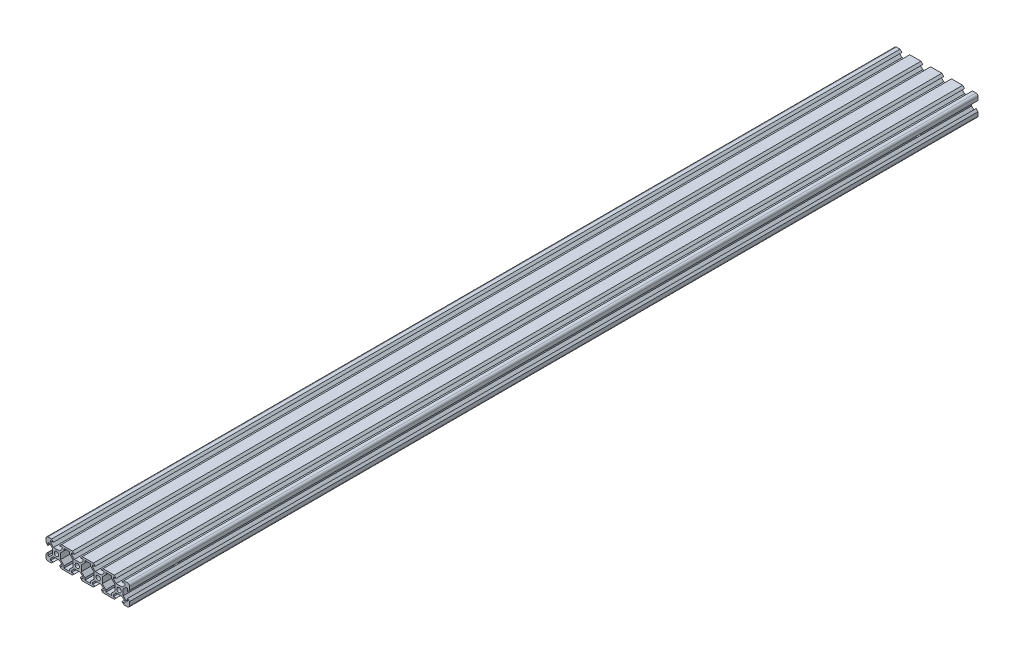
SolidWorks part; units mm, degrees
ref_plane "Front Plane" through (0, 0, 0) normal (0, 0, 1) x (1, 0, 0)
ref_plane "Top Plane" through (0, 0, 0) normal (0, 1, 0) x (1, 0, 0)
ref_plane "Right Plane" through (0, 0, 0) normal (1, 0, 0) x (0, 0, -1)
imported_body "Imported1"
sketch "Sketch1" plane through (0, 0, 25.4) normal (0, 0, 1) x (1, 0, 0)
  line L12 (-17.3007, -8.2) -> (-17.3007, -6.24)
  line L13 (-22.6993, -8.2) -> (-17.3007, -8.2)
  line L14 (-22.6993, -6.24) -> (-22.6993, -8.2)
  line L15 (-26.0993, -2.84) -> (-22.6993, -6.24)
  line L16 (-26.0993, 2.84) -> (-26.0993, -2.84)
  line L17 (-22.6993, 6.24) -> (-26.0993, 2.84)
  line L18 (-22.6993, 8.2) -> (-22.6993, 6.24)
  line L19 (-17.3007, 8.2) -> (-22.6993, 8.2)
  line L20 (-17.3007, 6.24) -> (-17.3007, 8.2)
  line L21 (-13.9007, 2.84) -> (-17.3007, 6.24)
  line L22 (-13.9007, -2.84) -> (-13.9007, 2.84)
  line L23 (-17.3007, -6.24) -> (-13.9007, -2.84)
  line L24 (-17.3007, -8.2) -> (-17.3007, -6.24)
  line L25 (-22.6993, -8.2) -> (-17.3007, -8.2)
  line L26 (-22.6993, -6.24) -> (-22.6993, -8.2)
  line L27 (-26.0993, -2.84) -> (-22.6993, -6.24)
  line L28 (-26.0993, 2.84) -> (-26.0993, -2.84)
  line L29 (-22.6993, 6.24) -> (-26.0993, 2.84)
  line L30 (-22.6993, 8.2) -> (-22.6993, 6.24)
  line L31 (-17.3007, 8.2) -> (-22.6993, 8.2)
  line L32 (-17.3007, 6.24) -> (-17.3007, 8.2)
  line L33 (-13.9007, 2.84) -> (-17.3007, 6.24)
  line L34 (-13.9007, -2.84) -> (-13.9007, 2.84)
  line L35 (-17.3007, -6.24) -> (-13.9007, -2.84)
  line L36 (-2.6993, 8.2) -> (-2.6993, 6.24)
  line L37 (2.6993, 8.2) -> (-2.6993, 8.2)
  line L38 (2.6993, 6.24) -> (2.6993, 8.2)
  line L39 (6.0993, 2.84) -> (2.6993, 6.24)
  line L40 (6.0993, -2.84) -> (6.0993, 2.84)
  line L41 (2.6993, -6.24) -> (6.0993, -2.84)
  line L42 (2.6993, -8.2) -> (2.6993, -6.24)
  line L43 (-2.6993, -8.2) -> (2.6993, -8.2)
  line L44 (-2.6993, -6.24) -> (-2.6993, -8.2)
  line L45 (-6.0993, -2.84) -> (-2.6993, -6.24)
  line L46 (-6.0993, 2.84) -> (-6.0993, -2.84)
  line L47 (-2.6993, 6.24) -> (-6.0993, 2.84)
  line L48 (-2.6993, 8.2) -> (-2.6993, 6.24)
  line L49 (2.6993, 8.2) -> (-2.6993, 8.2)
  line L50 (2.6993, 6.24) -> (2.6993, 8.2)
  line L51 (6.0993, 2.84) -> (2.6993, 6.24)
  line L52 (6.0993, -2.84) -> (6.0993, 2.84)
  line L53 (2.6993, -6.24) -> (6.0993, -2.84)
  line L54 (2.6993, -8.2) -> (2.6993, -6.24)
  line L55 (-2.6993, -8.2) -> (2.6993, -8.2)
  line L56 (-2.6993, -6.24) -> (-2.6993, -8.2)
  line L57 (-6.0993, -2.84) -> (-2.6993, -6.24)
  line L58 (-6.0993, 2.84) -> (-6.0993, -2.84)
  line L59 (-2.6993, 6.24) -> (-6.0993, 2.84)
  line L60 (13.9007, 2.84) -> (13.9007, -2.84)
  line L61 (17.3007, 6.24) -> (13.9007, 2.84)
  line L62 (17.3007, 8.2) -> (17.3007, 6.24)
  line L63 (22.6993, 8.2) -> (17.3007, 8.2)
  line L64 (22.6993, 6.24) -> (22.6993, 8.2)
  line L65 (26.0993, 2.84) -> (22.6993, 6.24)
  line L66 (26.0993, -2.84) -> (26.0993, 2.84)
  line L67 (22.6993, -6.24) -> (26.0993, -2.84)
  line L68 (22.6993, -8.2) -> (22.6993, -6.24)
  line L69 (17.3007, -8.2) -> (22.6993, -8.2)
  line L70 (17.3007, -6.24) -> (17.3007, -8.2)
  line L71 (13.9007, -2.84) -> (17.3007, -6.24)
  line L72 (13.9007, 2.84) -> (13.9007, -2.84)
  line L73 (17.3007, 6.24) -> (13.9007, 2.84)
  line L74 (17.3007, 8.2) -> (17.3007, 6.24)
  line L75 (22.6993, 8.2) -> (17.3007, 8.2)
  line L76 (22.6993, 6.24) -> (22.6993, 8.2)
  line L77 (26.0993, 2.84) -> (22.6993, 6.24)
  line L78 (26.0993, -2.84) -> (26.0993, 2.84)
  line L79 (22.6993, -6.24) -> (26.0993, -2.84)
  line L80 (22.6993, -8.2) -> (22.6993, -6.24)
  line L81 (17.3007, -8.2) -> (22.6993, -8.2)
  line L82 (17.3007, -6.24) -> (17.3007, -8.2)
  line L83 (13.9007, -2.84) -> (17.3007, -6.24)
  line L104 (-15.4993, -8.2) -> (-15.4993, -6.56)
  line L105 (-15.4993, -6.56) -> (-12.84, -3.9007)
  line L106 (-12.84, -3.9007) -> (-7.16, -3.9007)
  line L107 (-7.16, -3.9007) -> (-4.5007, -6.56)
  line L108 (-4.5007, -6.56) -> (-4.5007, -8.2)
  line L109 (-4.5007, -8.2) -> (-7.16, -8.2)
  line L110 (-7.16, -8.2) -> (-5.36, -10)
  line L111 (-5.36, -10) -> (5.36, -10)
  line L112 (5.36, -10) -> (7.16, -8.2)
  line L113 (7.16, -8.2) -> (4.5007, -8.2)
  line L114 (4.5007, -8.2) -> (4.5007, -6.56)
  line L115 (4.5007, -6.56) -> (7.16, -3.9007)
  line L116 (7.16, -3.9007) -> (12.84, -3.9007)
  line L117 (12.84, -3.9007) -> (15.4993, -6.56)
  line L118 (15.4993, -6.56) -> (15.4993, -8.2)
  line L119 (15.4993, -8.2) -> (12.84, -8.2)
  line L120 (12.84, -8.2) -> (14.64, -10)
  line L121 (14.64, -10) -> (25.36, -10)
  line L122 (25.36, -10) -> (27.16, -8.2)
  line L123 (27.16, -8.2) -> (24.5007, -8.2)
  line L124 (24.5007, -8.2) -> (24.5007, -6.56)
  line L125 (24.5007, -6.56) -> (27.16, -3.9007)
  line L126 (27.16, -3.9007) -> (32.84, -3.9007)
  line L127 (32.84, -3.9007) -> (35.4993, -6.56)
  line L128 (35.4993, -6.56) -> (35.4993, -8.2)
  line L129 (35.4993, -8.2) -> (32.84, -8.2)
  line L130 (32.84, -8.2) -> (34.64, -10)
  line L131 (34.64, -10) -> (38, -10)
  line L132 (40, -8) -> (40, -4.64)
  line L133 (40, -4.64) -> (38.2, -2.84)
  line L134 (38.2, -2.84) -> (38.2, -5.4993)
  line L135 (38.2, -5.4993) -> (36.56, -5.4993)
  line L136 (36.56, -5.4993) -> (33.9007, -2.84)
  line L137 (33.9007, -2.84) -> (33.9007, 2.84)
  line L138 (33.9007, 2.84) -> (36.56, 5.4993)
  line L139 (36.56, 5.4993) -> (38.2, 5.4993)
  line L140 (38.2, 5.4993) -> (38.2, 2.84)
  line L141 (38.2, 2.84) -> (40, 4.64)
  line L142 (40, 4.64) -> (40, 8)
  line L143 (38, 10) -> (34.64, 10)
  line L144 (34.64, 10) -> (32.84, 8.2)
  line L145 (32.84, 8.2) -> (35.4993, 8.2)
  line L146 (35.4993, 8.2) -> (35.4993, 6.56)
  line L147 (35.4993, 6.56) -> (32.84, 3.9007)
  line L148 (32.84, 3.9007) -> (27.16, 3.9007)
  line L149 (27.16, 3.9007) -> (24.5007, 6.56)
  line L150 (24.5007, 6.56) -> (24.5007, 8.2)
  line L151 (24.5007, 8.2) -> (27.16, 8.2)
  line L152 (27.16, 8.2) -> (25.36, 10)
  line L153 (25.36, 10) -> (14.64, 10)
  line L154 (14.64, 10) -> (12.84, 8.2)
  line L155 (12.84, 8.2) -> (15.4993, 8.2)
  line L156 (15.4993, 8.2) -> (15.4993, 6.56)
  line L157 (15.4993, 6.56) -> (12.84, 3.9007)
  line L158 (12.84, 3.9007) -> (7.16, 3.9007)
  line L159 (7.16, 3.9007) -> (4.5007, 6.56)
  line L160 (4.5007, 6.56) -> (4.5007, 8.2)
  line L161 (4.5007, 8.2) -> (7.16, 8.2)
  line L162 (7.16, 8.2) -> (5.36, 10)
  line L163 (5.36, 10) -> (-5.36, 10)
  line L164 (-5.36, 10) -> (-7.16, 8.2)
  line L165 (-7.16, 8.2) -> (-4.5007, 8.2)
  line L166 (-4.5007, 8.2) -> (-4.5007, 6.56)
  line L167 (-4.5007, 6.56) -> (-7.16, 3.9007)
  line L168 (-7.16, 3.9007) -> (-12.84, 3.9007)
  line L169 (-12.84, 3.9007) -> (-15.4993, 6.56)
  line L170 (-15.4993, 6.56) -> (-15.4993, 8.2)
  line L171 (-15.4993, 8.2) -> (-12.84, 8.2)
  line L172 (-12.84, 8.2) -> (-14.64, 10)
  line L173 (-14.64, 10) -> (-25.36, 10)
  line L174 (-25.36, 10) -> (-27.16, 8.2)
  line L175 (-27.16, 8.2) -> (-24.5007, 8.2)
  line L176 (-24.5007, 8.2) -> (-24.5007, 6.56)
  line L177 (-24.5007, 6.56) -> (-27.16, 3.9007)
  line L178 (-27.16, 3.9007) -> (-32.84, 3.9007)
  line L179 (-32.84, 3.9007) -> (-35.4993, 6.56)
  line L180 (-35.4993, 6.56) -> (-35.4993, 8.2)
  line L181 (-35.4993, 8.2) -> (-32.84, 8.2)
  line L182 (-32.84, 8.2) -> (-34.64, 10)
  line L183 (-34.64, 10) -> (-38, 10)
  line L184 (-40, 8) -> (-40, 4.64)
  line L185 (-40, 4.64) -> (-38.2, 2.84)
  line L186 (-38.2, 2.84) -> (-38.2, 5.4993)
  line L187 (-38.2, 5.4993) -> (-36.56, 5.4993)
  line L188 (-36.56, 5.4993) -> (-33.9007, 2.84)
  line L189 (-33.9007, 2.84) -> (-33.9007, -2.84)
  line L190 (-33.9007, -2.84) -> (-36.56, -5.4993)
  line L191 (-36.56, -5.4993) -> (-38.2, -5.4993)
  line L192 (-38.2, -5.4993) -> (-38.2, -2.84)
  line L193 (-38.2, -2.84) -> (-40, -4.64)
  line L194 (-40, -4.64) -> (-40, -8)
  line L195 (-38, -10) -> (-34.64, -10)
  line L196 (-34.64, -10) -> (-32.84, -8.2)
  line L197 (-32.84, -8.2) -> (-35.4993, -8.2)
  line L198 (-35.4993, -8.2) -> (-35.4993, -6.56)
  line L199 (-35.4993, -6.56) -> (-32.84, -3.9007)
  line L200 (-32.84, -3.9007) -> (-27.16, -3.9007)
  line L201 (-27.16, -3.9007) -> (-24.5007, -6.56)
  line L202 (-24.5007, -6.56) -> (-24.5007, -8.2)
  line L203 (-24.5007, -8.2) -> (-27.16, -8.2)
  line L204 (-27.16, -8.2) -> (-25.36, -10)
  line L205 (-25.36, -10) -> (-14.64, -10)
  line L206 (-14.64, -10) -> (-12.84, -8.2)
  line L207 (-12.84, -8.2) -> (-15.4993, -8.2)
  line L208 (-15.4993, -8.2) -> (-15.4993, -6.56)
  line L209 (-15.4993, -6.56) -> (-12.84, -3.9007)
  line L210 (-12.84, -3.9007) -> (-7.16, -3.9007)
  line L211 (-7.16, -3.9007) -> (-4.5007, -6.56)
  line L212 (-4.5007, -6.56) -> (-4.5007, -8.2)
  line L213 (-4.5007, -8.2) -> (-7.16, -8.2)
  line L214 (-7.16, -8.2) -> (-5.36, -10)
  line L215 (-5.36, -10) -> (5.36, -10)
  line L216 (5.36, -10) -> (7.16, -8.2)
  line L217 (7.16, -8.2) -> (4.5007, -8.2)
  line L218 (4.5007, -8.2) -> (4.5007, -6.56)
  line L219 (4.5007, -6.56) -> (7.16, -3.9007)
  line L220 (7.16, -3.9007) -> (12.84, -3.9007)
  line L221 (12.84, -3.9007) -> (15.4993, -6.56)
  line L222 (15.4993, -6.56) -> (15.4993, -8.2)
  line L223 (15.4993, -8.2) -> (12.84, -8.2)
  line L224 (12.84, -8.2) -> (14.64, -10)
  line L225 (14.64, -10) -> (25.36, -10)
  line L226 (25.36, -10) -> (27.16, -8.2)
  line L227 (27.16, -8.2) -> (24.5007, -8.2)
  line L228 (24.5007, -8.2) -> (24.5007, -6.56)
  line L229 (24.5007, -6.56) -> (27.16, -3.9007)
  line L230 (27.16, -3.9007) -> (32.84, -3.9007)
  line L231 (32.84, -3.9007) -> (35.4993, -6.56)
  line L232 (35.4993, -6.56) -> (35.4993, -8.2)
  line L233 (35.4993, -8.2) -> (32.84, -8.2)
  line L234 (32.84, -8.2) -> (34.64, -10)
  line L235 (34.64, -10) -> (38, -10)
  line L236 (40, -8) -> (40, -4.64)
  line L237 (40, -4.64) -> (38.2, -2.84)
  line L238 (38.2, -2.84) -> (38.2, -5.4993)
  line L239 (38.2, -5.4993) -> (36.56, -5.4993)
  line L240 (36.56, -5.4993) -> (33.9007, -2.84)
  line L241 (33.9007, -2.84) -> (33.9007, 2.84)
  line L242 (33.9007, 2.84) -> (36.56, 5.4993)
  line L243 (36.56, 5.4993) -> (38.2, 5.4993)
  line L244 (38.2, 5.4993) -> (38.2, 2.84)
  line L245 (38.2, 2.84) -> (40, 4.64)
  line L246 (40, 4.64) -> (40, 8)
  line L247 (38, 10) -> (34.64, 10)
  line L248 (34.64, 10) -> (32.84, 8.2)
  line L249 (32.84, 8.2) -> (35.4993, 8.2)
  line L250 (35.4993, 8.2) -> (35.4993, 6.56)
  line L251 (35.4993, 6.56) -> (32.84, 3.9007)
  line L252 (32.84, 3.9007) -> (27.16, 3.9007)
  line L253 (27.16, 3.9007) -> (24.5007, 6.56)
  line L254 (24.5007, 6.56) -> (24.5007, 8.2)
  line L255 (24.5007, 8.2) -> (27.16, 8.2)
  line L256 (27.16, 8.2) -> (25.36, 10)
  line L257 (25.36, 10) -> (14.64, 10)
  line L258 (14.64, 10) -> (12.84, 8.2)
  line L259 (12.84, 8.2) -> (15.4993, 8.2)
  line L260 (15.4993, 8.2) -> (15.4993, 6.56)
  line L261 (15.4993, 6.56) -> (12.84, 3.9007)
  line L262 (12.84, 3.9007) -> (7.16, 3.9007)
  line L263 (7.16, 3.9007) -> (4.5007, 6.56)
  line L264 (4.5007, 6.56) -> (4.5007, 8.2)
  line L265 (4.5007, 8.2) -> (7.16, 8.2)
  line L266 (7.16, 8.2) -> (5.36, 10)
  line L267 (5.36, 10) -> (-5.36, 10)
  line L268 (-5.36, 10) -> (-7.16, 8.2)
  line L269 (-7.16, 8.2) -> (-4.5007, 8.2)
  line L270 (-4.5007, 8.2) -> (-4.5007, 6.56)
  line L271 (-4.5007, 6.56) -> (-7.16, 3.9007)
  line L272 (-7.16, 3.9007) -> (-12.84, 3.9007)
  line L273 (-12.84, 3.9007) -> (-15.4993, 6.56)
  line L274 (-15.4993, 6.56) -> (-15.4993, 8.2)
  line L275 (-15.4993, 8.2) -> (-12.84, 8.2)
  line L276 (-12.84, 8.2) -> (-14.64, 10)
  line L277 (-14.64, 10) -> (-25.36, 10)
  line L278 (-25.36, 10) -> (-27.16, 8.2)
  line L279 (-27.16, 8.2) -> (-24.5007, 8.2)
  line L280 (-24.5007, 8.2) -> (-24.5007, 6.56)
  line L281 (-24.5007, 6.56) -> (-27.16, 3.9007)
  line L282 (-27.16, 3.9007) -> (-32.84, 3.9007)
  line L283 (-32.84, 3.9007) -> (-35.4993, 6.56)
  line L284 (-35.4993, 6.56) -> (-35.4993, 8.2)
  line L285 (-35.4993, 8.2) -> (-32.84, 8.2)
  line L286 (-32.84, 8.2) -> (-34.64, 10)
  line L287 (-34.64, 10) -> (-38, 10)
  line L288 (-40, 8) -> (-40, 4.64)
  line L289 (-40, 4.64) -> (-38.2, 2.84)
  line L290 (-38.2, 2.84) -> (-38.2, 5.4993)
  line L291 (-38.2, 5.4993) -> (-36.56, 5.4993)
  line L292 (-36.56, 5.4993) -> (-33.9007, 2.84)
  line L293 (-33.9007, 2.84) -> (-33.9007, -2.84)
  line L294 (-33.9007, -2.84) -> (-36.56, -5.4993)
  line L295 (-36.56, -5.4993) -> (-38.2, -5.4993)
  line L296 (-38.2, -5.4993) -> (-38.2, -2.84)
  line L297 (-38.2, -2.84) -> (-40, -4.64)
  line L298 (-40, -4.64) -> (-40, -8)
  line L299 (-38, -10) -> (-34.64, -10)
  line L300 (-34.64, -10) -> (-32.84, -8.2)
  line L301 (-32.84, -8.2) -> (-35.4993, -8.2)
  line L302 (-35.4993, -8.2) -> (-35.4993, -6.56)
  line L303 (-35.4993, -6.56) -> (-32.84, -3.9007)
  line L304 (-32.84, -3.9007) -> (-27.16, -3.9007)
  line L305 (-27.16, -3.9007) -> (-24.5007, -6.56)
  line L306 (-24.5007, -6.56) -> (-24.5007, -8.2)
  line L307 (-24.5007, -8.2) -> (-27.16, -8.2)
  line L308 (-27.16, -8.2) -> (-25.36, -10)
  line L309 (-25.36, -10) -> (-14.64, -10)
  line L310 (-14.64, -10) -> (-12.84, -8.2)
  line L311 (-12.84, -8.2) -> (-15.4993, -8.2)
  circle A0 centre (-30, 0) radius 2.1 construction
  circle A1 centre (-10, 0) radius 2.1 construction
  circle A2 centre (10, 0) radius 2.1 construction
  circle A3 centre (30, 0) radius 2.1 construction
  arc A4 (38, -10) -> (40, -8) centre (38, -8) ccw
  arc A5 (40, 8) -> (38, 10) centre (38, 8) ccw
  arc A6 (-38, 10) -> (-40, 8) centre (-38, 8) ccw
  arc A7 (-40, -8) -> (-38, -10) centre (-38, -8) ccw
  arc A8 (38, -10) -> (40, -8) centre (38, -8) ccw
  arc A9 (40, 8) -> (38, 10) centre (38, 8) ccw
  arc A10 (-38, 10) -> (-40, 8) centre (-38, 8) ccw
  arc A11 (-40, -8) -> (-38, -10) centre (-38, -8) ccw
  circle A12 centre (-30, 0) radius 2.1
  circle A13 centre (-10, 0) radius 2.1
  circle A14 centre (10, 0) radius 2.1
  circle A15 centre (30, 0) radius 2.1
  dimension "D1" = 0
  dimension "D2" = 0
  dimension "D3" = 0
  dimension "D4" = 0
extrude "Boss-Extrude1" add sketch "Sketch1" along normal blind 787.4
ref_plane "Plane1" through (0, 0, 0) normal (0, -1, 0) x (1, 0, 0)
sketch "Sketch2" plane through (33.9007, 0, 0) normal (-1, 0, 0) x (0, 0, 1)
  line L0 (0, -2.84) -> (0, 2.84) construction
  circle A0 centre (50.8, 0) radius 3.175
  dimension "D1" = 6.35
  dimension "D2" = 50.8
extrude "Cut-Extrude1" cut sketch "Sketch2" along normal blind 25.4
ref_plane "Plane2" through (0, 0, 406.4) normal (0, 0, -1) x (-1, 0, 0)
mirror "Mirror1" about plane through (0, 0, 406.4) normal (0, 0, -1) of "Cut-Extrude1"
